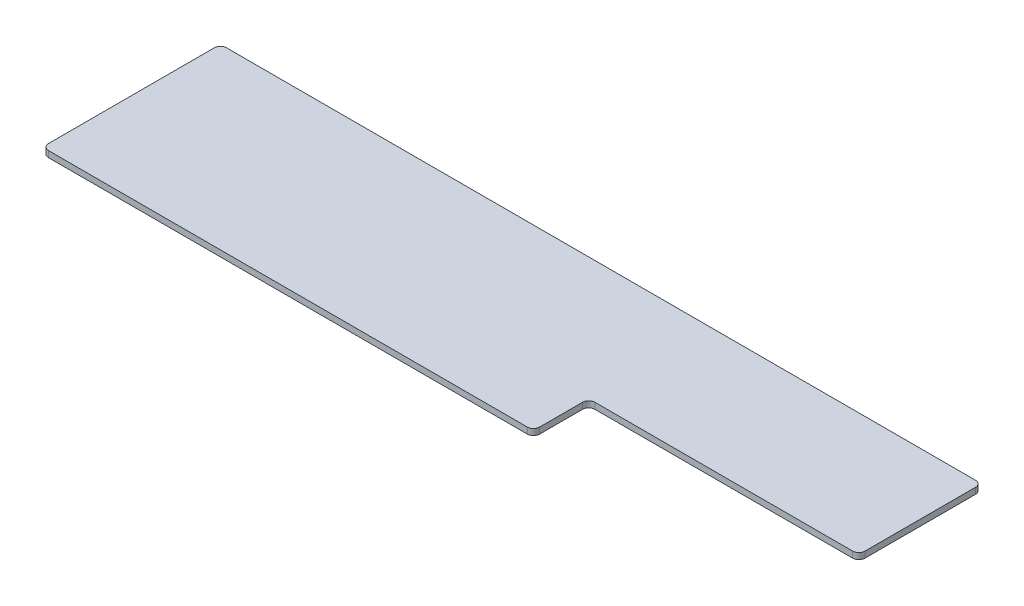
SolidWorks part; units mm, degrees
ref_plane "Front Plane" through (0, 0, 0) normal (0, 0, 1) x (1, 0, 0)
ref_plane "Top Plane" through (0, 0, 0) normal (0, 1, 0) x (1, 0, 0)
ref_plane "Right Plane" through (0, 0, 0) normal (1, 0, 0) x (0, 0, -1)
sketch "Sketch1" plane through (0, 0, 0) normal (0, 1, 0) x (1, 0, 0)
  line L0 (0, 0) -> (-620, 0)
  line L1 (-620, 0) -> (-620, -145)
  line L2 (-620, -145) -> (-220, -145)
  line L3 (-220, -145) -> (-220, -100)
  line L4 (-220, -100) -> (0, -100)
  line L5 (0, -100) -> (0, 0)
  dimension "D1" = 100
  dimension "D2" = 145
  dimension "D3" = 620
  dimension "D4" = 400
sheet metal parameters "Sheet-Metal1" thickness 5 parameters "D1"=0.7366
base flange "Base-Flange1" sketch "Sketch1" thickness 5 reverse thickness direction no parameters "D1"=0.7366
break corner "Break-Corner1" thickness 5 parameters "D1"=5, "D0"=5, "D7"=5
flat pattern "Flat-Pattern1"
sketch "Bend-Lines1" plane through (0, 0, 0) normal (0, 1, 0) x (-1, 0, 0)
sketch3d "Bounding-Box1" [suppressed]
  line L0 (-620, 144.9998, 0) -> (0, 145.0001, 0) construction
  line L1 (-619.9999, 0, 0) -> (0, 0.0003, 0) construction
  line L2 (-620, 144.9998, 0) -> (-619.9999, 0, 0) construction
  line L3 (0, 145.0001, 0) -> (0, 0.0003, 0) construction
